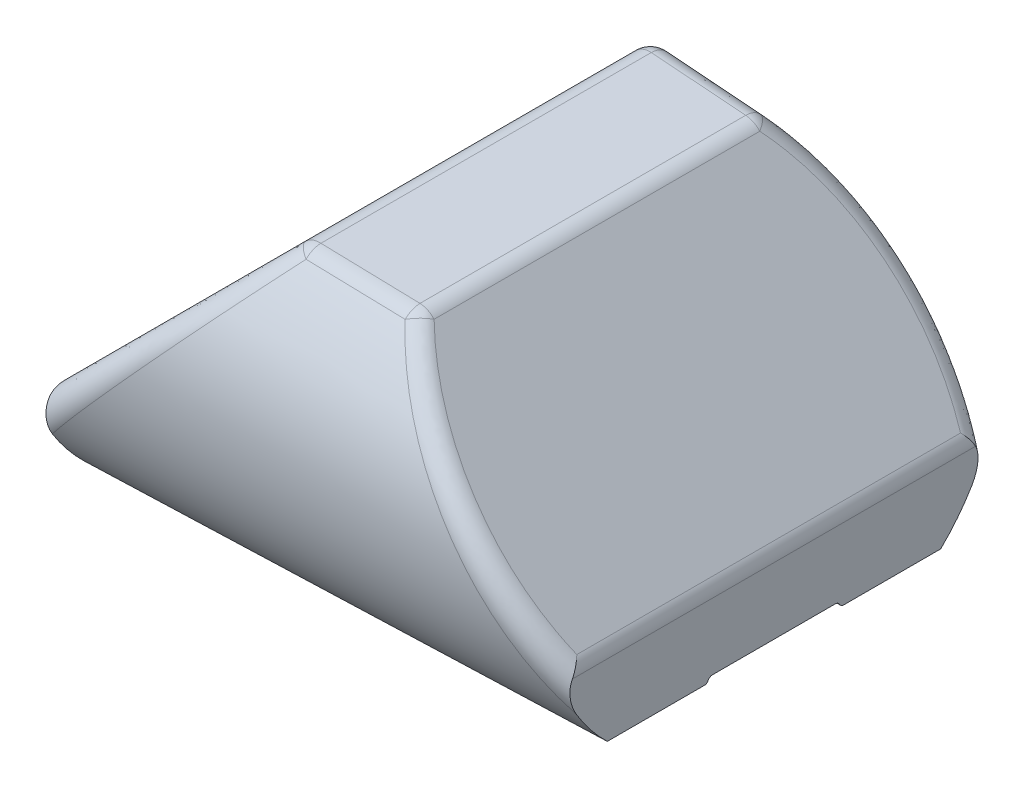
SolidWorks part; units mm, degrees
ref_plane "Front Plane" through (0, 0, 0) normal (0, 0, 1) x (1, 0, 0)
ref_plane "Top Plane" through (0, 0, 0) normal (0, 1, 0) x (1, 0, 0)
ref_plane "Right Plane" through (0, 0, 0) normal (1, 0, 0) x (0, 0, -1)
sketch "Sketch2" plane through (0, 0, 0) normal (1, 0, 0) x (0, 0, -1)
  line L0 (0, 0) -> (17.54, 0)
  line L2 (17.54, -14.88) -> (0, -14.88)
  line L4 (8.77, 0) -> (8.77, -14.88) construction
  arc A0 (17.54, 0) -> (17.54, -14.88) centre (10.2589, -7.44) cw
  arc A1 (0, 0) -> (0, -14.88) centre (7.2811, -7.44) ccw
  dimension "D3" = 10.41
  dimension "D1" = 14.88
  dimension "D2" = 17.54
ref_plane "Plane1" through (25, 0, 0) normal (1, 0, 0) x (0, 0, -1)
sketch "Sketch3" plane through (25, 0, 0) normal (1, 0, 0) x (0, 0, -1)
  line L0 (0.615, -1.26) -> (16.925, -1.26)
  line L2 (16.925, -14.58) -> (0.615, -14.58)
  line L4 (8.77, -1.26) -> (8.77, -14.58) construction
  line L5 (8.77, 0) -> (8.77, -14.88) construction
  line L6 (17.54, -14.88) -> (0, -14.88) construction
  arc A0 (16.925, -1.26) -> (16.925, -14.58) centre (10.5057, -7.92) cw
  arc A1 (0.615, -1.26) -> (0.615, -14.58) centre (7.0343, -7.92) ccw
  dimension "D3" = 9.25
  dimension "D1" = 16.31
  dimension "D2" = 13.32
  dimension "D4" = 0.3
loft "Loft1" add profiles "Sketch2", "Sketch3"
chamfer "Chamfer1" distance 11 angle 45 1 edges
chamfer "Chamfer2" distance 8.95 angle 45 1 edges
fillet "Fillet1" radius 1 10 edges at (21.1452, -6.433, 2.25) (19.0181, -4.0801, -19.2158) (16.0613, -0.8095, -8.77) (10.4722, -0.5278, -8.77) (7.4296, -3.5704, 2.0233) (4.61, -6.39, -20.4366)
ref_plane "Plane2" through (0.1785, -14.8779, 0) normal (0.012, -0.9999, 0) x (-0.9999, -0.012, 0)
sketch "Sketch4" plane through (0.1785, -14.8779, 0) normal (0.012, -0.9999, 0) x (-0.9999, -0.012, 0)
  line L0 (-24.8652, 12.02) -> (0.1785, 12.02)
  line L1 (-24.8652, 18.634) -> (-24.8652, -1.094) construction
  line L2 (0.1785, 0) -> (0.1785, 17.54) construction
  line L3 (0.1785, 12.02) -> (0.1785, 5.52)
  line L4 (0.1785, 5.52) -> (-24.8652, 5.52)
  line L5 (-24.8652, 5.52) -> (-24.8652, 12.02)
  line L6 (-12.3433, 12.02) -> (-12.3433, 17.232) construction
  line L7 (0.1785, 17.54) -> (-24.8233, 16.925) construction
  line L8 (-12.3433, 5.52) -> (-12.3433, 0.308) construction
  line L9 (0.1785, 0) -> (-24.8233, 0.615) construction
  dimension "D1" = 6.5
extrude "Cut-Extrude1" cut sketch "Sketch4" against normal blind 0.25
fillet "Fillet2" radius 0.25 2 edges at (12.5, -14.48, -12.02) (12.5, -14.48, -5.52)
fillet "Fillet3" radius 0.2 2 edges
